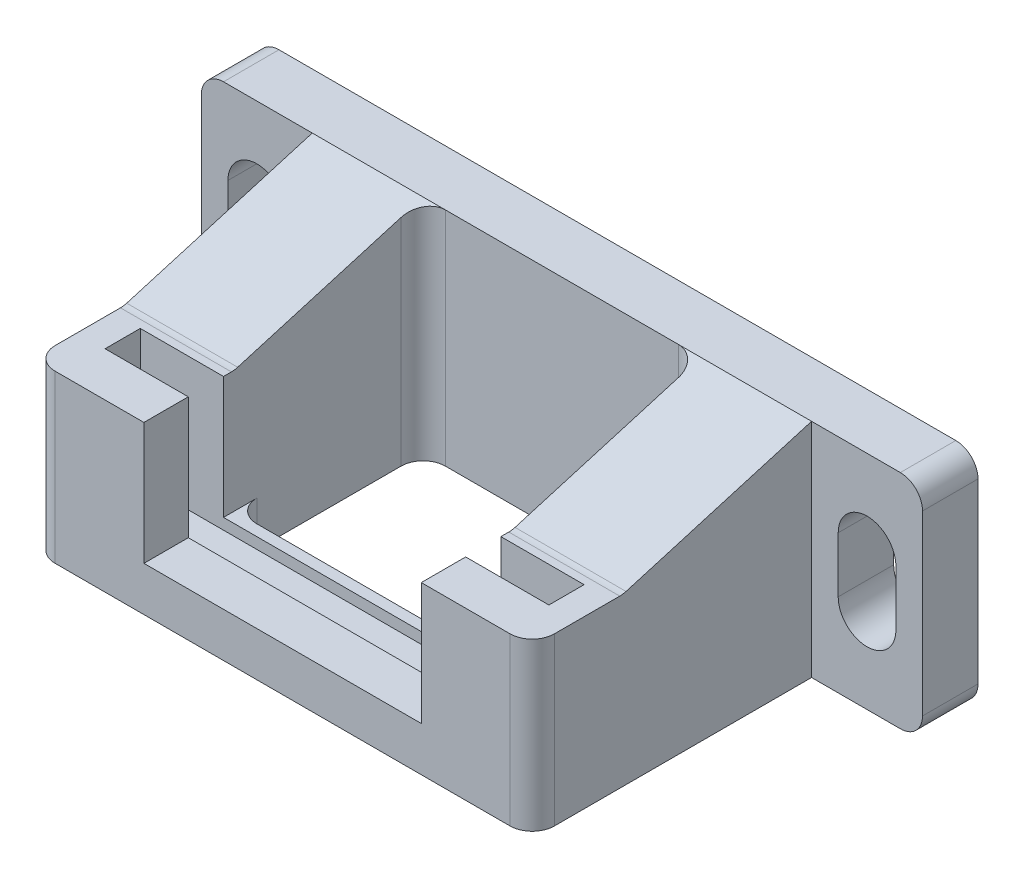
SolidWorks part; units mm, degrees
ref_plane "Front" through (0, 0, 0) normal (0, 0, 1) x (1, 0, 0)
ref_plane "Top" through (0, 0, 0) normal (0, 1, 0) x (1, 0, 0)
ref_plane "Right" through (0, 0, 0) normal (1, 0, 0) x (0, 0, -1)
sketch "Sketch1" plane through (0, 0, 0) normal (1, 0, 0) x (0, 0, -1)
  line L0 (0, 20) -> (0, 0)
  line L1 (0, 0) -> (-30.175, 0)
  line L2 (-30.175, 0) -> (-30.175, 6)
  line L3 (-30.175, 6) -> (-26.175, 6)
  line L4 (-26.175, 6) -> (-26.175, 3)
  line L5 (-26.175, 3) -> (-23, 3)
  line L6 (-23, 3) -> (-23, 6)
  line L7 (-23, 6) -> (-22, 6)
  line L8 (-22, 6) -> (-22, 3)
  line L9 (-22, 3) -> (-5, 3)
  line L10 (-5, 3) -> (-5, 20)
  line L11 (-5, 20) -> (0, 20)
  dimension "D1" = 23
  dimension "D2" = 1
  dimension "D3" = 3.175
  dimension "D4" = 6
  dimension "D5" = 20
  dimension "D7" = 5
  dimension "D8" = 3
  dimension "D9" = 4
extrude "Boss-Extrude1" add sketch "Sketch1" along normal blind 25
ref_plane "Plane1" through (12.5, 0, 0) normal (1, 0, 0) x (0, 0, -1)
sketch "Sketch2" plane through (25, 0, 0) normal (1, 0, 0) x (0, 0, -1)
  line L0 (-30.175, 15) -> (-22, 15)
  line L1 (-22, 15) -> (-5, 20)
  line L2 (-30.175, 6) -> (-30.175, 0) construction
  line L3 (-30.175, 0) -> (0, 0) construction
  line L4 (0, 0) -> (0, 20) construction
  line L5 (0, 20) -> (-5, 20) construction
  line L6 (-30.175, 15) -> (-30.175, 0)
  line L7 (-30.175, 0) -> (0, 0)
  line L8 (0, 0) -> (0, 20)
  line L9 (0, 20) -> (-5, 20)
  line L10 (-22, 15) -> (-22, 6) construction
  dimension "D1" = 5
extrude "Boss-Extrude2" add sketch "Sketch2" along normal blind 10
mirror "Mirror1" about plane through (12.5, 0, 0) normal (1, 0, 0) of "Boss-Extrude2"
sketch "Sketch3" plane through (0, 0, 30.175) normal (0, 0, 1) x (1, 0, 0)
  line L1 (0, 6) -> (25, 6)
  line L2 (0, 6) -> (0, 4)
  line L3 (0, 4) -> (25, 4)
  line L4 (25, 6) -> (25, 4)
  dimension "D1" = 2
extrude "Cut-Extrude1" cut sketch "Sketch3" against normal up to surface (8.175 mm away)
sketch "Sketch8" plane through (0, 15, 0) normal (0, 1, 0) x (1, 0, 0)
  line L0 (25, -26.175) -> (0, -26.175) construction
  line L1 (-7.5, -26.175) -> (32.5, -26.175)
  line L2 (-7.5, -26.175) -> (-7.5, -23)
  line L3 (-7.5, -23) -> (32.5, -23)
  line L4 (32.5, -26.175) -> (32.5, -23)
  line L5 (25, -23) -> (0, -23) construction
  line L6 (-7.5, -26.175) -> (-10, -26.175) construction
  line L7 (-10, -22) -> (-10, -30.175) construction
  line L8 (32.5, -26.175) -> (35, -26.175) construction
  line L9 (35, -22) -> (35, -30.175) construction
  dimension "D1" = 2.5
extrude "Cut-Extrude4" cut sketch "Sketch8" against normal up to surface (12 mm away)
sketch "Sketch5" plane through (0, 0, 0) normal (0, -1, 0) x (1, 0, 0)
  line L0 (0, 5) -> (0, 22) construction
  line L1 (0, 5) -> (25, 5)
  line L2 (0, 5) -> (0, 22)
  line L3 (0, 22) -> (25, 22)
  line L4 (25, 5) -> (25, 22)
  line L5 (25, 22) -> (25, 5) construction
  line L8 (35, 0) -> (-10, 0) construction
  dimension "D2" = 5
extrude "Cut-Extrude3" cut sketch "Sketch5" against normal blind 3.175
sketch "Sketch6" plane through (0, 0, 0) normal (0, 0, -1) x (-1, 0, 0)
  line L0 (-40, 20) -> (-40, 0) construction
  line L1 (-35, 20) -> (-45, 20)
  line L2 (-35, 20) -> (-35, 0)
  line L3 (-35, 0) -> (-45, 0)
  line L4 (-45, 20) -> (-45, 0)
  line L5 (-40, 7.5) -> (-40, 12.5) construction
  line L6 (-42.6, 7.5) -> (-42.6, 12.5)
  line L7 (-37.4, 7.5) -> (-37.4, 12.5)
  line L8 (-35, 0) -> (10, 0) construction
  arc A0 (-42.6, 7.5) -> (-37.4, 7.5) centre (-40, 7.5) ccw
  arc A1 (-37.4, 12.5) -> (-42.6, 12.5) centre (-40, 12.5) ccw
  point P9 (-40, 10)
  dimension "D1" = 2.6
  dimension "D2" = 10
  dimension "D3" = 5
extrude "Boss-Extrude3" add sketch "Sketch6" against normal blind 5
fillet "Fillet1" radius 2 8 edges at (25, 2, 22) (0, 2, 22) (0, 10, 5) (30, 15, 22) (35, 7.5, 30.175) (-10, 7.5, 30.175) (-5, 15, 22) (25, 10, 5)
fillet "Fillet2" radius 2 2 edges at (45, 0, 2.5) (45, 20, 2.5)
mirror "Mirror2" about plane through (12.5, 0, 0) normal (1, 0, 0) of "Fillet2", "Boss-Extrude3"
sketch "Sketch9" plane through (-10, 0, 0) normal (-1, 0, 0) x (0, 0, 1)
  line L0 (5, 3) -> (30.175, 3) construction
  line L1 (5, 18) -> (5, 2) construction
  line L2 (30.175, 15) -> (30.175, 0) construction
  line L3 (28.175, 0) -> (5, 0) construction
  text T0 "ZWP-02" font "Century Gothic" height in points 18
  point P6 (0, 0)
  dimension "D1" = 3
extrude "Cut-Extrude5" cut sketch "Sketch9" against normal blind 0.4
